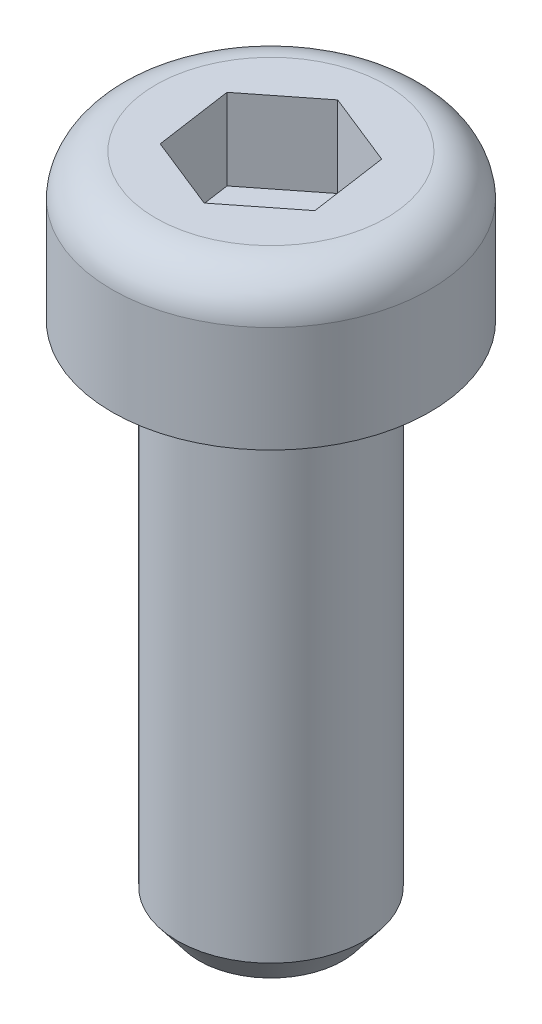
SolidWorks part; units mm, degrees
ref_plane "Ebene vorne" through (0, 0, 0) normal (0, 0, 1) x (1, 0, 0)
ref_plane "Ebene oben" through (0, 0, 0) normal (0, 1, 0) x (1, 0, 0)
ref_plane "Ebene rechts" through (0, 0, 0) normal (1, 0, 0) x (0, 0, -1)
sketch "Skizze1" plane through (0, 0, 0) normal (0, 0, 1) x (1, 0, 0)
  line L0 (0, 0) -> (0, -60.4931) construction
  line L1 (0, -31.9874) -> (0, 1.4647)
  line L2 (0, 1.4647) -> (-1.5317, 1.4647)
  line L3 (-1.5317, 1.4647) -> (-1.5317, 9.0196)
  line L4 (-1.5317, 9.0196) -> (-7.112, 9.0196)
  line L5 (-9.797, 6.5412) -> (-9.797, 0)
  line L6 (-9.797, 0) -> (-5.7695, 0)
  line L7 (-5.7695, 0) -> (-5.7695, -30.2466)
  line L8 (-5.7695, -30.2466) -> (-4.427, -31.9874)
  line L9 (-4.427, -31.9874) -> (0, -31.9874)
  arc A0 (-7.112, 9.0196) -> (-9.797, 6.5412) centre (-7.112, 6.326) ccw
revolve "Rotation1" add sketch "Skizze1" angle 360 about L0
sketch "Skizze2" plane through (0, 9.0196, 0) normal (0, 1, 0) x (1, 0, 0)
  line L1 (-0.6936, 4.8122) -> (-4.5143, 1.8054)
  line L2 (-4.5143, 1.8054) -> (-3.8207, -3.0068)
  line L3 (-3.8207, -3.0068) -> (0.6936, -4.8122)
  line L4 (0.6936, -4.8122) -> (4.5143, -1.8054)
  line L5 (4.5143, -1.8054) -> (3.8207, 3.0068)
  line L6 (3.8207, 3.0068) -> (-0.6936, 4.8122)
  circle A0 centre (0, 0) radius 4.2106 construction
extrude "Schnitt-Linear austragen1" cut sketch "Skizze2" against normal blind 5
equation "\"LÄNGE\"=0"
equation "\"BREITE\"=0"
equation "\"HÖHE\"=0"
equation "\"DURCHMESSER\"=0"
equation "\"Stückzahl\"= 1"
